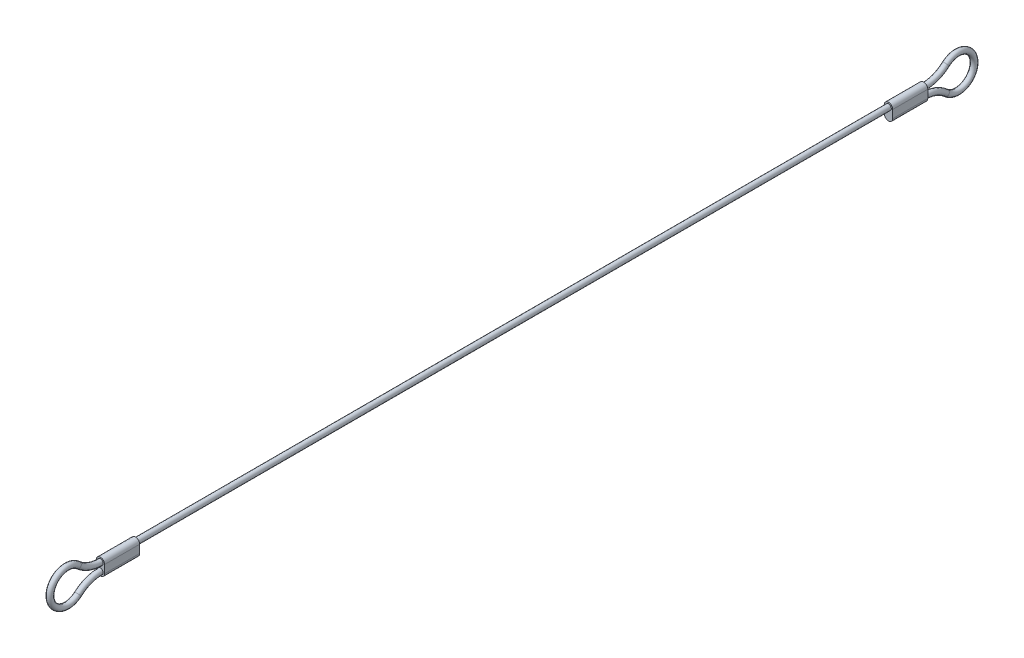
SolidWorks part; units mm, degrees
ref_plane "Front Plane" through (0, 0, 0) normal (0, 0, 1) x (1, 0, 0)
ref_plane "Top Plane" through (0, 0, 0) normal (0, 1, 0) x (1, 0, 0)
ref_plane "Right Plane" through (0, 0, 0) normal (1, 0, 0) x (0, 0, -1)
sketch "Sketch1" plane through (0, 0, 0) normal (1, 0, 0) x (0, 0, -1)
  line L0 (117.4, 0) -> (-117.4, 0)
  line L1 (0, 2.1945) -> (0, -2.1945) construction
  arc A0 (-117.4, 0) -> (-123.8, 2.4446) centre (-117.4, 9.6) cw
  arc A1 (-123.8, 2.4446) -> (-123.8, -4.7108) centre (-127, -1.1331) ccw
  arc A2 (-123.8, -4.7108) -> (-117.4, -2.2663) centre (-117.4, -11.8663) cw
  arc A3 (123.8, -4.7108) -> (117.4, -2.2663) centre (117.4, -11.8663) ccw
  arc A4 (123.8, 2.4446) -> (123.8, -4.7108) centre (127, -1.1331) cw
  arc A5 (117.4, 0) -> (123.8, 2.4446) centre (117.4, 9.6) ccw
  point P18 (0, 0)
  dimension "D1" = 4.8
  dimension "D4" = 9.6
  dimension "D2" = 127
  dimension "D3" = 9.6
sketch "Sketch2" plane through (0, 0, 0) normal (0, 0, 1) x (1, 0, 0)
  circle A0 centre (0, 0) radius 0.795
  dimension "D1" = 1.59
sweep "Sweep1" add profiles "Sketch2" path "Sketch1"
sketch "Sketch3" plane through (0, 0, 117.4) normal (0, 0, -1) x (-1, 0, 0)
  line L0 (0, 0) -> (0, -2.2663) construction
  line L1 (1.2, 0) -> (1.2, -2.2663)
  line L2 (-1.2, 0) -> (-1.2, -2.2663)
  line L3 (-0.795, -2.2663) -> (0.795, -2.2663) construction
  arc A0 (1.2, 0) -> (-1.2, 0) centre (0, 0) ccw
  arc A1 (-1.2, -2.2663) -> (1.2, -2.2663) centre (0, -2.2663) ccw
  point P3 (0, -1.1331)
  dimension "D1" = 2.4
extrude "Boss-Extrude1" add sketch "Sketch3" along normal blind 10
mirror "Mirror1" about plane through (0, 0, 0) normal (0, 0, 1) of "Boss-Extrude1"
